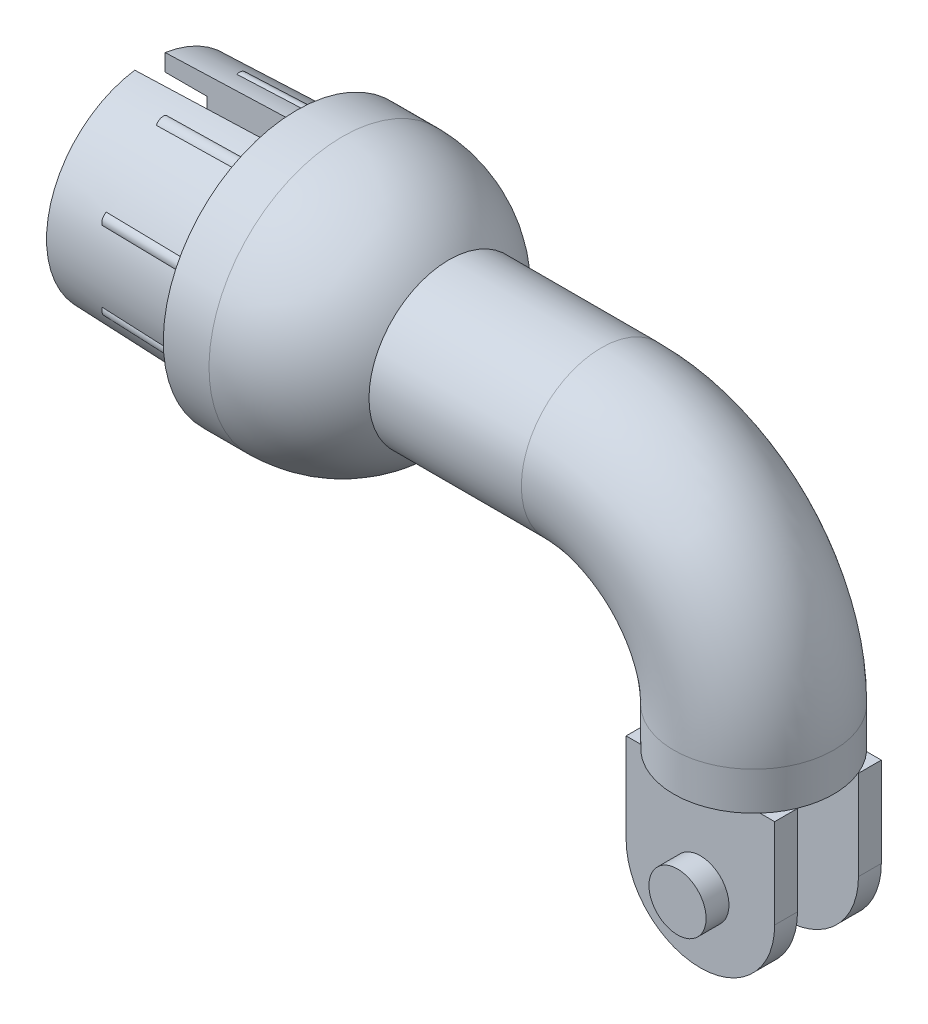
SolidWorks part; units mm, degrees
ref_plane "Front" through (0, 0, 0) normal (0, 0, 1) x (1, 0, 0)
ref_plane "Top" through (0, 0, 0) normal (0, 1, 0) x (1, 0, 0)
ref_plane "Right" through (0, 0, 0) normal (1, 0, 0) x (0, 0, -1)
ref_plane "Plane4" through (0, 6.35, 0) normal (0, 1, 0) x (-1, 0, 0)
sketch "Sketch1" plane through (0, 6.35, 0) normal (0, 1, 0) x (-1, 0, 0)
  circle A0 centre (0, 0) radius 5.334
  dimension "D1" = 10.668
sketch "Sketch2" plane through (0, 0, 0) normal (0, 0, 1) x (1, 0, 0)
  line L0 (0, 6.35) -> (0, 8.89)
  line L1 (-10.16, 19.05) -> (-25.4, 19.05)
  line L2 (50, 6.35) -> (-50, 6.35) construction
  arc A0 (-10.16, 19.05) -> (0, 8.89) centre (-10.16, 8.89) cw
  point P8 (0, 19.05)
  dimension "D3" = 10.16
  dimension "D1" = 12.7
  dimension "D2" = 25.4
sweep "Base-Sweep" add profiles "Sketch1" path "Sketch2"
sketch "Sketch3" plane through (0, 0, 0) normal (0, 0, 1) x (1, 0, 0)
  line L0 (-36.1722, 19.05) -> (-64.353, 19.05) construction
  line L1 (-10.16, 19.05) -> (-25.4, 19.05) construction
  line L2 (-27.432, 27.94) -> (-30.48, 27.94)
  line L3 (-30.48, 27.94) -> (-30.48, 19.05)
  line L4 (-30.48, 19.05) -> (-18.542, 19.05)
  line L5 (0, -50) -> (0, 50) construction
  line L6 (-10.16, 24.384) -> (-25.4, 24.384) construction
  line L7 (-10.16, 24.384) -> (-25.4, 24.384) construction
  arc A0 (-18.542, 19.05) -> (-27.432, 27.94) centre (-27.432, 19.05) ccw
  point P13 (-20.32, 24.384)
  dimension "D3" = 8.89
  dimension "D1" = 17.78
  dimension "D2" = 30.48
  dimension "D4" = 3.048
  dimension "D5" = 20.32
revolve "Boss-Revolve1" add sketch "Sketch3" angle 360 about L0
sketch "Sketch4" plane through (-30.48, 0, 0) normal (-1, 0, 0) x (0, 0, 1)
  circle A0 centre (0, 19.05) radius 7.239
  dimension "D1" = 14.478
extrude "Boss-Extrude1" add sketch "Sketch4" along normal blind 9.779 draft 2
shell "Shell1" thickness 2.032
ref_plane "Plane5" through (0, 2.7898, 6.7352) normal (0, 0.3827, 0.9239) x (1, 0, 0)
sketch "Sketch6" plane through (0, 2.7898, 6.7352) normal (0, 0.3827, 0.9239) x (1, 0, 0)
  line L0 (-36.83, 24.6172) -> (-30.48, 24.8389)
  line L1 (-30.48, 24.8389) -> (-40.259, 24.4974) construction
  dimension "D1" = 6.35
sketch "Sketch7" plane through (-30.48, 0, 0) normal (-1, 0, 0) x (0, 0, 1)
  line L0 (12.0969, -10.1545) -> (1.3735, 15.7341) construction
  line L1 (-2.6244, 25.386) -> (-2.8765, 25.9944) construction
  circle A0 centre (-2.6244, 25.386) radius 0.508
  circle A1 centre (0, 19.05) radius 7.239 construction
  circle A2 centre (0, 19.05) radius 7.239 construction
  dimension "D1" = 1.016
  dimension "D2" = 0.127
sweep "Boss-Sweep1" add profiles "Sketch7" path "Sketch6"
pattern_circular "CirPattern1" count 8 every 45 about axis through (-36.1722, 19.05, 0) along (-1, 0, 0) of "Boss-Sweep1"
sketch "Sketch8" plane through (-40.259, 0, 0) normal (-1, 0, 0) x (0, 0, 1)
  circle A0 centre (0, 19.05) radius 5.7785
  dimension "D1" = 11.557
extrude "Cut-Extrude1" cut sketch "Sketch8" against normal blind 2.794
sketch "Sketch9" plane through (0, 0, 0) normal (0, 1, 0) x (1, 0, 0)
  line L1 (-31.115, 1.016) -> (-31.115, -1.016)
  line L2 (-40.259, 1.016) -> (-31.115, 1.016)
  line L3 (-40.259, 1.016) -> (-40.259, -1.016)
  line L4 (-31.115, -1.016) -> (-40.259, -1.016)
  line L5 (-50, 0) -> (50, 0) construction
  line L6 (-40.259, 6.8975) -> (-40.259, -6.8975) construction
  line L7 (-30.48, 8.89) -> (-30.48, -8.89) construction
  point P5 (-40.259, 0)
  dimension "D1" = 2.032
  dimension "D2" = 0.635
extrude "Cut-Extrude2" cut sketch "Sketch9" along normal through all
ref_plane "Plane6" through (0, 0, -3.556) normal (0, 0, 1) x (1, 0, 0)
sketch "Sketch10" plane through (0, 12.319, -3.556) normal (0, 0, -1) x (1, 0, 0)
  line L0 (-4.953, 5.969) -> (4.953, 5.969)
  line L1 (-4.953, 5.969) -> (-4.953, 11.938)
  line L3 (4.953, 11.938) -> (4.953, 5.969)
  line L4 (0, -37.681) -> (0, 62.319) construction
  line L5 (5.334, 5.969) -> (-5.334, 5.969) construction
  arc A0 (-4.953, 11.938) -> (4.953, 11.938) centre (0, 11.938) cw
  dimension "D1" = 9.906
  dimension "D2" = 10.922
extrude "Boss-Extrude2" add sketch "Sketch10" against normal blind 1.524
sketch "Sketch11" plane through (0, 0, -3.556) normal (0, 0, -1) x (-1, 0, 0)
  circle A0 centre (0, 0) radius 1.905
  dimension "D1" = 3.81
extrude "Boss-Extrude3" add sketch "Sketch11" along normal blind 1.524
mirror "Mirror1" about plane through (0, 0, 0) normal (0, 0, 1) of "Boss-Extrude3", "Boss-Extrude2"
